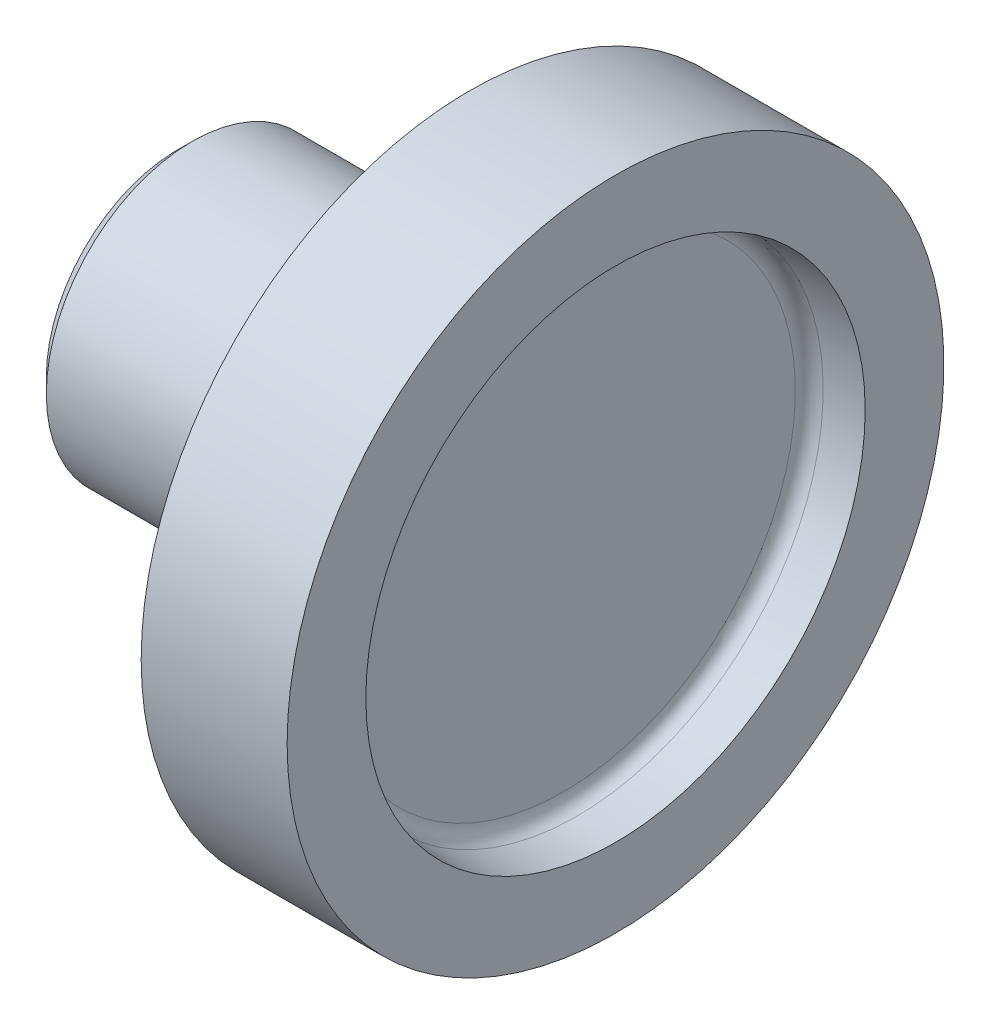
SolidWorks part; units mm, degrees
ref_plane "Plan de face" through (0, 0, 0) normal (0, 0, 1) x (1, 0, 0)
ref_plane "Plan de dessus" through (0, 0, 0) normal (0, 1, 0) x (1, 0, 0)
ref_plane "Plan de droite" through (0, 0, 0) normal (1, 0, 0) x (0, 0, -1)
sketch "Esquisse1" plane through (0, 0, 0) normal (0, 0, 1) x (1, 0, 0)
  line L0 (-50.3534, 0) -> (61.3976, 0) construction
  line L1 (-23.3252, 0) -> (-23.3252, 9)
  line L2 (-22.3252, 10) -> (-3.3252, 10)
  line L3 (-3.3252, 10) -> (-3.3252, 22.5)
  line L4 (-3.3252, 22.5) -> (6.6748, 22.5)
  line L5 (6.6748, 22.5) -> (6.6748, 17.1085)
  line L6 (6.6748, 17.1085) -> (4.0276, 16.8769)
  line L7 (3.1148, 15.8807) -> (3.1148, 0)
  line L8 (-23.3252, 9) -> (-22.3252, 10)
  line L9 (-23.3252, 0) -> (3.1148, 0)
  arc A0 (4.0276, 16.8769) -> (3.1148, 15.8807) centre (4.1148, 15.8807) ccw
  point P4 (-23.3252, 10)
  point P13 (3.1148, 16.797)
  dimension "D8" = 1
  dimension "D1" = 20
  dimension "D2" = 45
  dimension "D3" = 3.56
  dimension "D4" = 20
  dimension "D5" = 30
  dimension "D6" = 5
  dimension "D7" = 33.594
revolve "Révolution1" add sketch "Esquisse1" angle 360 about L0
